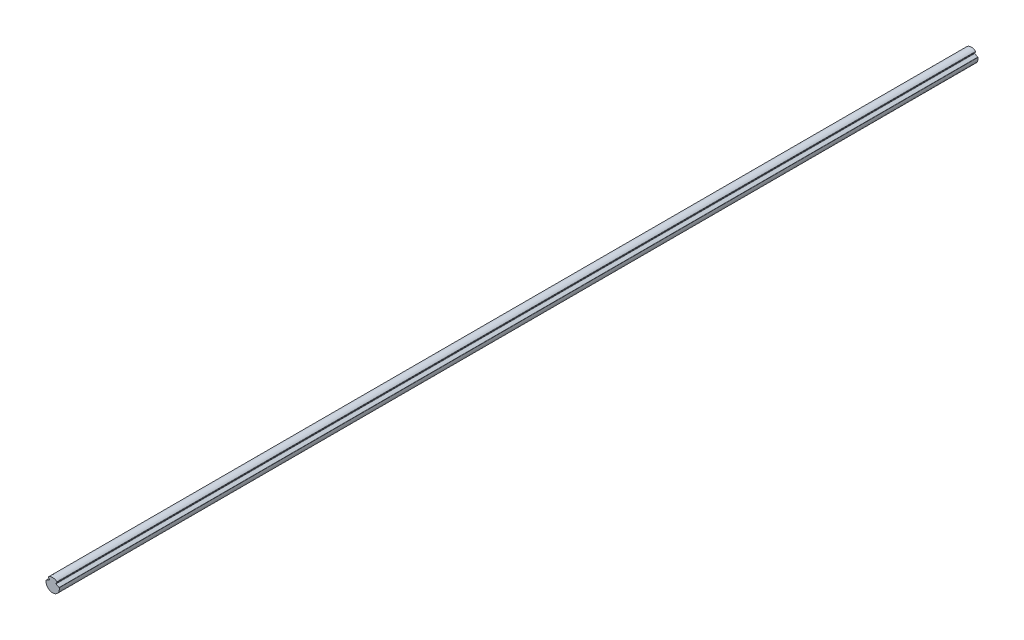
SolidWorks part; units mm, degrees
ref_plane "Plan de face" through (0, 0, 0) normal (0, 0, 1) x (1, 0, 0)
ref_plane "Plan de dessus" through (0, 0, 0) normal (0, 1, 0) x (1, 0, 0)
ref_plane "Plan de droite" through (0, 0, 0) normal (1, 0, 0) x (0, 0, -1)
sketch "Esquisse1" plane through (0, 0, 0) normal (0, 0, 1) x (1, 0, 0)
  line L0 (0, 71.5187) -> (0, -71.5187) construction
  line L1 (-10.6851, 3.25) -> (15.4512, 3.25) construction
  line L2 (3.6901, 3.0257) -> (6.9575, 1.3609)
  line L3 (-3.5609, 3.6339) -> (-4.6839, 5.0207)
  line L4 (-3.6901, 3.0257) -> (-6.9575, 1.3609)
  line L5 (3.5609, 3.6339) -> (4.6839, 5.0207)
  arc A0 (-7.1716, 1.0632) -> (7.1716, 1.0632) centre (0, 0) ccw
  arc A1 (-4.6839, 5.0207) -> (-4.6284, 5.5803) centre (-4.3731, 5.2725) cw
  arc A2 (-6.9575, 1.3609) -> (-7.1716, 1.0632) centre (-6.7759, 1.0045) ccw
  arc A3 (-3.6901, 3.0257) -> (-3.5609, 3.6339) centre (-3.8717, 3.3821) ccw
  arc A4 (3.6901, 3.0257) -> (3.5609, 3.6339) centre (3.8717, 3.3821) cw
  arc A5 (6.9575, 1.3609) -> (7.1716, 1.0632) centre (6.7759, 1.0045) cw
  arc A6 (4.6839, 5.0207) -> (4.6284, 5.5803) centre (4.3731, 5.2725) ccw
  arc A7 (4.6284, 5.5803) -> (-4.6284, 5.5803) centre (0, 0) ccw
  point P15 (-3.25, 3.25)
  point P25 (3.25, 3.25)
  dimension "D1" = 14.5
  dimension "D2" = 3.25
  dimension "D3" = 0.4
  dimension "D6" = 0.4
  dimension "D4" = 51
  dimension "D5" = 27
extrude "Boss.-Extru.1" add sketch "Esquisse1" along normal blind 1000
